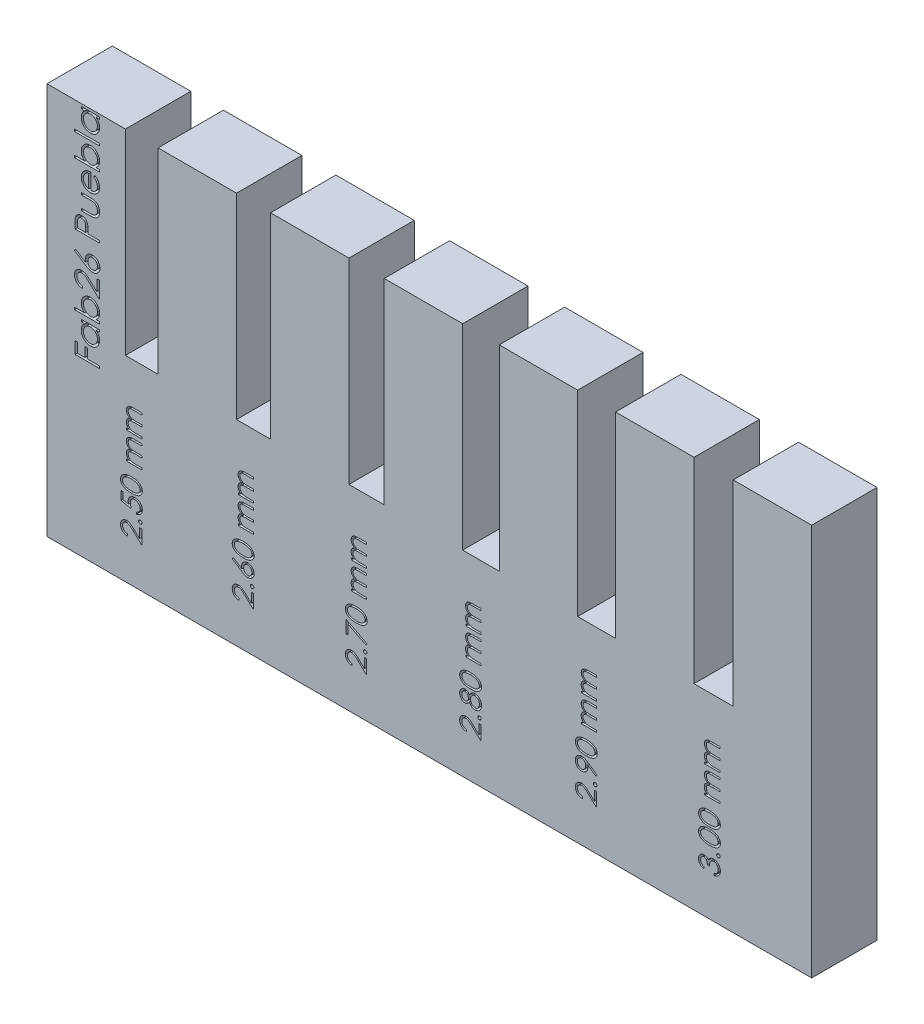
SolidWorks part; units mm, degrees
ref_plane "Alzado" through (0, 0, 0) normal (0, 0, 1) x (1, 0, 0)
ref_plane "Planta" through (0, 0, 0) normal (0, 1, 0) x (1, 0, 0)
ref_plane "Vista lateral" through (0, 0, 0) normal (1, 0, 0) x (0, 0, -1)
sketch "Croquis1" plane through (0, 0, 0) normal (0, 0, 1) x (1, 0, 0)
  line L26 (0, 0) -> (0, 30)
  line L32 (0, -16.5) -> (0, 16.5) construction
  line L33 (0, 30) -> (6, 30)
  line L34 (6, 30) -> (6, 15)
  line L35 (6, 15) -> (8.5, 15)
  line L36 (8.5, 15) -> (8.5, 30)
  line L37 (8.5, 30) -> (14.5, 30)
  line L38 (14.5, 30) -> (14.5, 15)
  line L39 (14.5, 15) -> (17.1, 15)
  line L40 (17.1, 15) -> (17.1, 30)
  line L41 (17.1, 30) -> (23.1, 30)
  line L42 (23.1, 30) -> (23.1, 15)
  line L43 (23.1, 15) -> (25.8, 15)
  line L44 (25.8, 15) -> (25.8, 30)
  line L45 (25.8, 30) -> (31.8, 30)
  line L46 (31.8, 30) -> (31.8, 15)
  line L47 (31.8, 15) -> (34.6, 15)
  line L48 (34.6, 15) -> (34.6, 30)
  line L49 (34.6, 30) -> (40.6, 30)
  line L50 (40.6, 30) -> (40.6, 15)
  line L51 (40.6, 15) -> (43.5, 15)
  line L52 (43.5, 15) -> (43.5, 30)
  line L53 (43.5, 30) -> (49.5, 30)
  line L54 (49.5, 30) -> (49.5, 15)
  line L55 (49.5, 15) -> (52.5, 15)
  line L56 (52.5, 15) -> (52.5, 30)
  line L57 (52.5, 30) -> (58.5, 30)
  line L60 (18.7, 0) -> (-18.7, 0) construction
  line L61 (58.5, 0) -> (0, 0)
  line L62 (58.5, 30) -> (58.5, 0)
  point P4 (0, 0)
  point P21 (0, 0)
  point P32 (12.0584, 30)
  dimension "D1" = 2.5
  dimension "D2" = 2.6
  dimension "D3" = 2.7
  dimension "D4" = 2.8
  dimension "D5" = 2.9
  dimension "D6" = 3
  dimension "D7" = 30
  dimension "D8" = 6
  dimension "D10" = 15
  dimension "D11" = 6
extrude "Saliente-Extruir1" add sketch "Croquis1" along normal blind 5
sketch "Croquis3" plane through (0, 0, 5) normal (0, 0, 1) x (1, 0, 0)
  line L0 (15.8, 15) -> (15.8, 0) construction
  line L2 (2.75, 0) -> (-2.75, 0) construction
  line L3 (7.25, 15) -> (7.25, 0) construction
  line L4 (8.5, 15) -> (6, 15) construction
  line L5 (17.1, 15) -> (14.5, 15) construction
  line L6 (24.45, 15) -> (24.45, 0) construction
  line L7 (25.8, 15) -> (23.1, 15) construction
  line L8 (33.2, 15) -> (33.2, 0) construction
  line L9 (34.6, 15) -> (31.8, 15) construction
  line L10 (42.05, 15) -> (42.05, 0) construction
  line L11 (43.5, 15) -> (40.6, 15) construction
  line L12 (51.4742, 15) -> (51.4742, 0) construction
  line L13 (52.5, 15) -> (49.5, 15) construction
  line L14 (4, 30) -> (4, 0) construction
  line L15 (6, 30) -> (0, 30) construction
  line L16 (6, 15) -> (6, 30) construction
  text T0 "2.60 mm" font "Century Gothic" height in points 6
  text T1 "2.50 mm" font "Century Gothic" height in points 6
  text T2 "2.70 mm" font "Century Gothic" height in points 6
  text T3 "2.80 mm" font "Century Gothic" height in points 6
  text T4 "2.90 mm" font "Century Gothic" height in points 6
  text T5 "3.00 mm" font "Century Gothic" height in points 6
  text T6 "Fab26 Puebla" font "Century Gothic" height in points 7
  point P28 (0, 0)
  point P29 (0, 0)
  dimension "D1" = 2
extrude "Cortar-Extruir1" cut sketch "Croquis3" against normal blind 0.5
